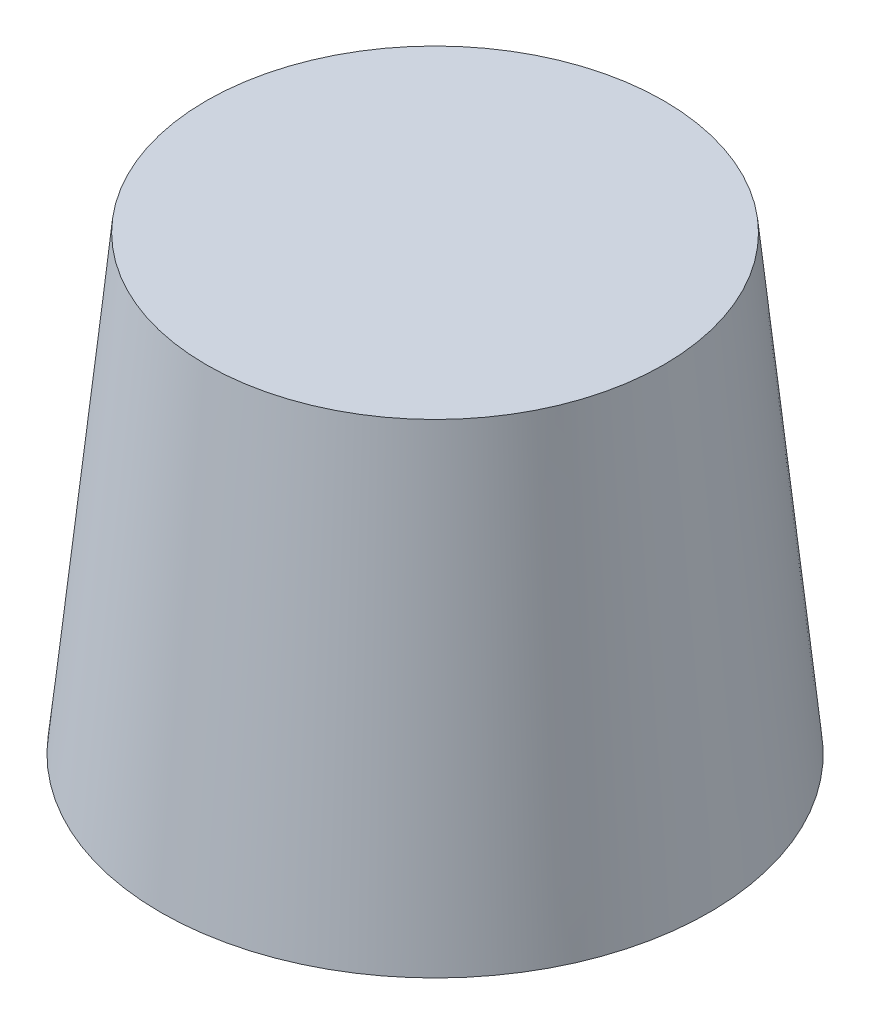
SolidWorks part; units mm, degrees
ref_plane "Front Plane" through (0, 0, 0) normal (0, 0, 1) x (1, 0, 0)
ref_plane "Top Plane" through (0, 0, 0) normal (0, 1, 0) x (1, 0, 0)
ref_plane "Right Plane" through (0, 0, 0) normal (1, 0, 0) x (0, 0, -1)
sketch "Sketch1" plane through (0, 0, 0) normal (0, 1, 0) x (1, 0, 0)
  circle A0 centre (0, 0) radius 90
  dimension "D1" = 180
ref_plane "Plane1" through (0, 0, 0) normal (0, 1, 0) x (1, 0, 0)
ref_plane "Plane2" through (0, 148, 0) normal (0, 1, 0) x (1, 0, 0)
sketch "Sketch2" plane through (0, 148, 0) normal (0, 1, 0) x (1, 0, 0)
  circle A0 centre (0, 0) radius 75
  dimension "D1" = 150
loft "Loft1" add profiles "Sketch2", "Sketch1"
